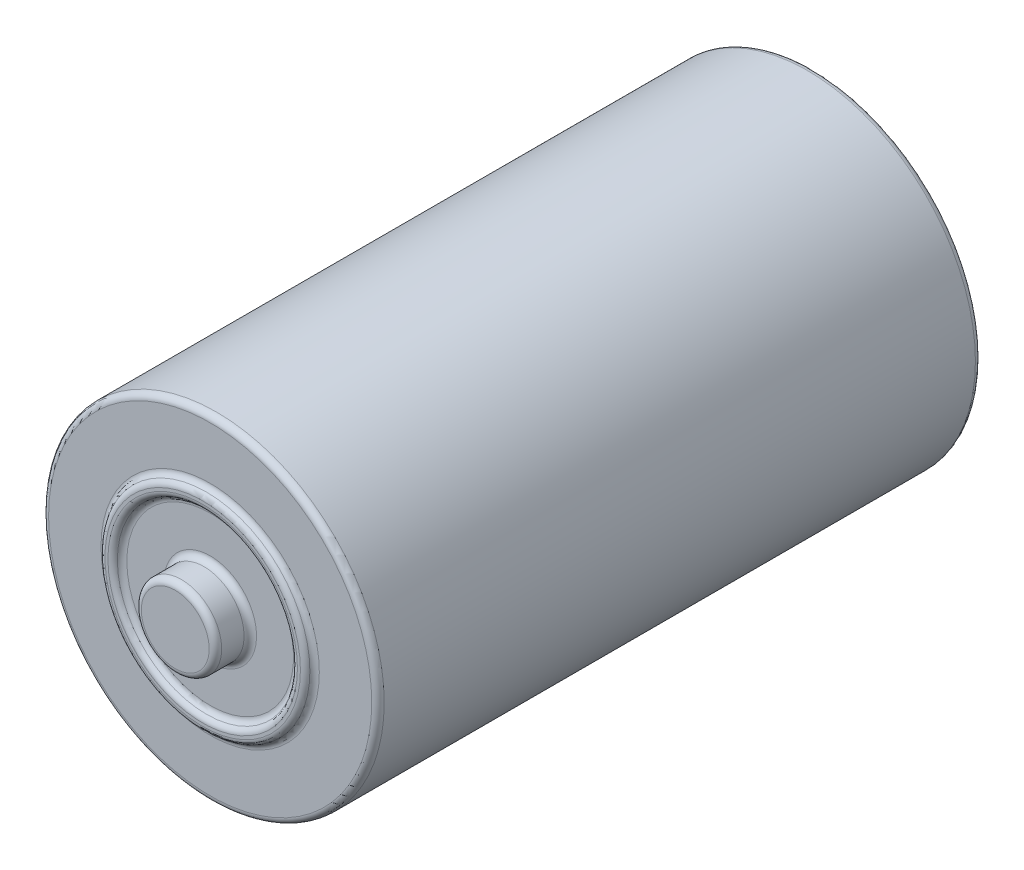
SolidWorks part; units mm, degrees
ref_plane "Front" through (0, 0, 0) normal (0, 0, 1) x (1, 0, 0)
ref_plane "Top" through (0, 0, 0) normal (0, 1, 0) x (1, 0, 0)
ref_plane "RT-Side" through (0, 0, 0) normal (1, 0, 0) x (0, 0, -1)
sketch "Sketch1" plane through (0, 0, 0) normal (1, 0, 0) x (0, 0, -1)
  line L0 (0, 17.0942) -> (61.4934, 17.0942)
  line L1 (0, 17.0942) -> (0, 0)
  line L2 (61.4934, 0) -> (0, 0)
  line L3 (61.4934, 0) -> (61.4934, 17.0942)
  line L4 (-20, 0) -> (180, 0) construction
  dimension "D1" = 17.0942
  dimension "D2" = 61.4934
revolve "Base-Revolve" add sketch "Sketch1" angle 360 about L4
sketch "Sketch2" plane through (0, 0, 0) normal (0, 0, 1) x (1, 0, 0)
  circle A0 centre (0, 0) radius 10.5918
  circle A1 centre (0, 0) radius 9.017
  dimension "D1" = 21.1836
  dimension "D2" = 18.034
extrude "Boss-Extrude1" add sketch "Sketch2" along normal blind 0.762
sketch "Sketch3" plane through (0, 0, 0) normal (0, 0, 1) x (1, 0, 0)
  circle A0 centre (0, 0) radius 4.0894
  dimension "D1" = 8.1788
extrude "Boss-Extrude2" add sketch "Sketch3" along normal blind 3.556
sketch "Sketch4" plane through (0, 0, -61.4934) normal (0, 0, -1) x (-1, 0, 0)
  circle A0 centre (0, 0) radius 9.525
  circle A1 centre (0, 0) radius 4.445
  dimension "D1" = 19.05
  dimension "D2" = 8.89
extrude "Boss-Extrude3" add sketch "Sketch4" along normal blind 0.762
sketch "Sketch5" plane through (0, 0, -61.4934) normal (0, 0, -1) x (-1, 0, 0)
  circle A0 centre (0, 0) radius 3.81
  dimension "D1" = 7.62
extrude "Boss-Extrude4" add sketch "Sketch5" along normal blind 0.762
fillet "Fillet14" radius 0.635
fillet "Fillet17" radius 0.635
fillet "Fillet19" radius 0.635
fillet "Fillet20" radius 0.635
